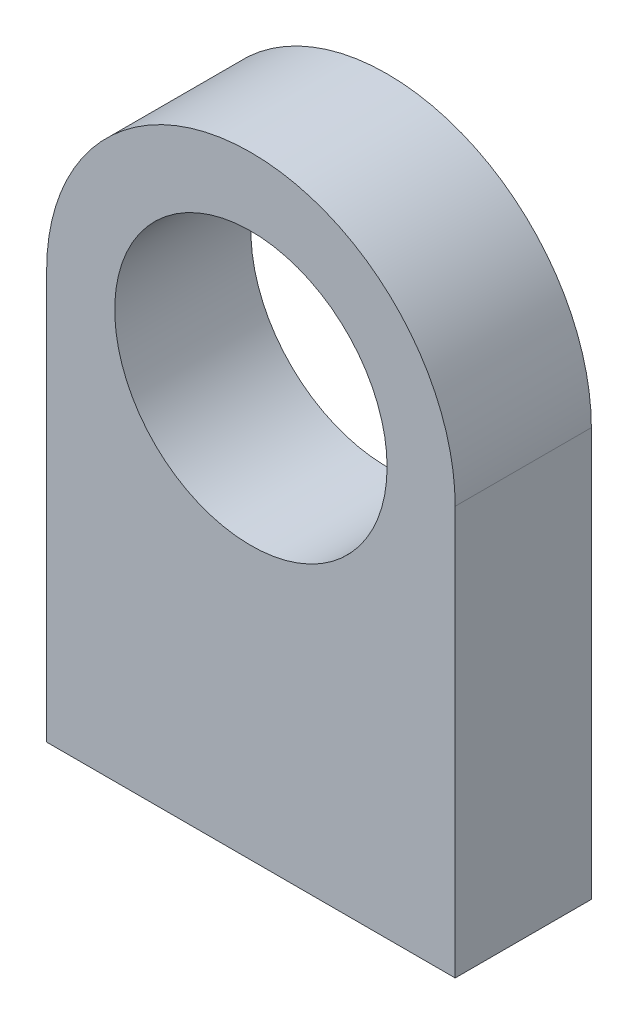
SolidWorks part; units mm, degrees
ref_plane "Front Plane" through (0, 0, 0) normal (0, 0, 1) x (1, 0, 0)
ref_plane "Top Plane" through (0, 0, 0) normal (0, 1, 0) x (1, 0, 0)
ref_plane "Right Plane" through (0, 0, 0) normal (1, 0, 0) x (0, 0, -1)
sketch "Sketch1" plane through (0, 0, 0) normal (0, 0, 1) x (1, 0, 0)
  line L0 (-15, 0) -> (-15, -30)
  line L1 (-15, -30) -> (15, -30)
  line L2 (15, -30) -> (15, 0)
  arc A0 (15, 0) -> (-15, 0) centre (0, 0) ccw
  dimension "D1" = 30
  dimension "D2" = 30
extrude "Boss-Extrude1" add sketch "Sketch1" along normal blind 10
sketch "Sketch2" plane through (0, 0, 10) normal (0, 0, 1) x (1, 0, 0)
  circle A0 centre (0, 0) radius 10
  dimension "D1" = 20
extrude "Cut-Extrude1" cut sketch "Sketch2" against normal through all
